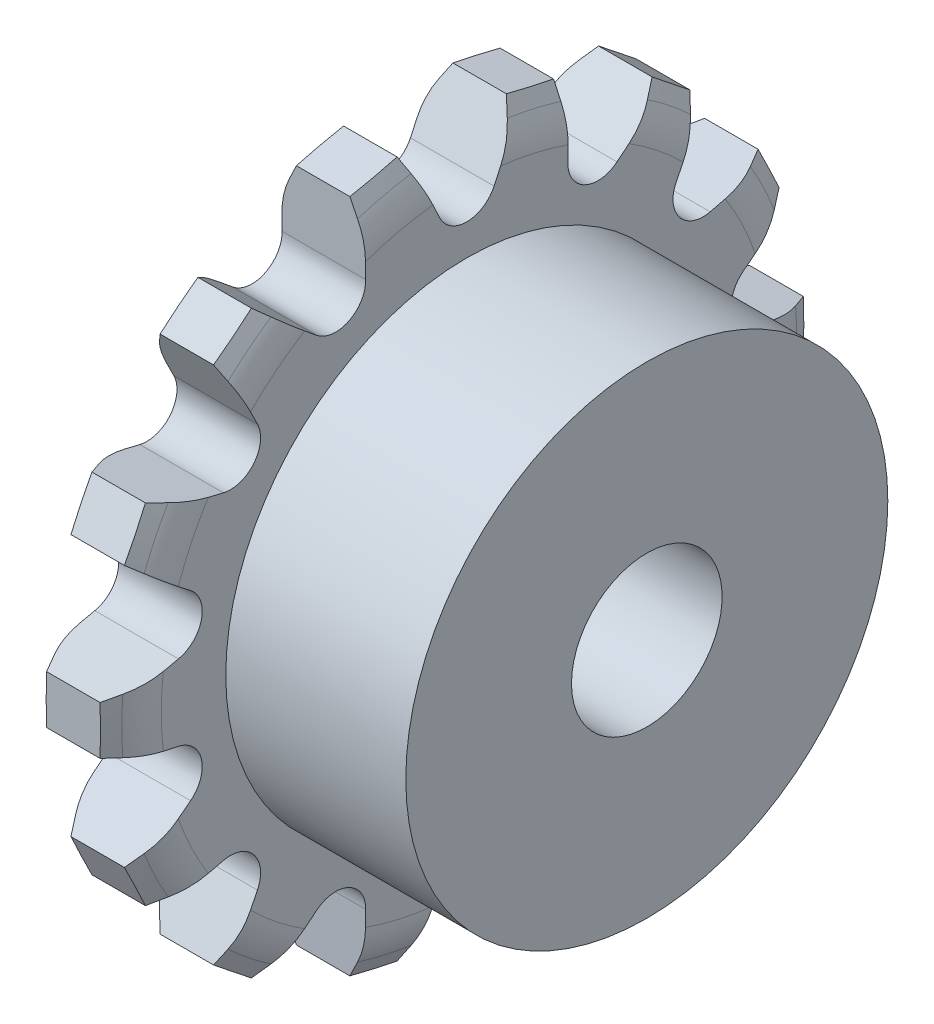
SolidWorks part; units mm, degrees
ref_plane "Plan de face" through (0, 0, 0) normal (0, 0, 1) x (1, 0, 0)
ref_plane "Plan de dessus" through (0, 0, 0) normal (0, 1, 0) x (1, 0, 0)
ref_plane "Plan de droite" through (0, 0, 0) normal (1, 0, 0) x (0, 0, -1)
sketch "Esquisse1" plane through (0, 0, 0) normal (0, 0, 1) x (1, 0, 0)
  line L0 (0, 40.5598) -> (0, 10)
  line L2 (35, 10) -> (35, 32)
  line L3 (35, 32) -> (11.1, 32)
  line L4 (11.1, 32) -> (11.1, 40.5598)
  line L5 (10.0949, 44.8126) -> (9.1, 46.8)
  line L6 (9.1, 46.8) -> (2, 46.8)
  line L7 (2, 46.8) -> (1.0051, 44.8126)
  line L8 (35, 0) -> (0, 0) construction
  line L9 (0, 10) -> (35, 10)
  arc A0 (11.1, 40.5598) -> (10.0949, 44.8126) centre (1.6, 40.5598) ccw
  arc A1 (1.0051, 44.8126) -> (0, 40.5598) centre (9.5, 40.5598) ccw
  dimension "D1" = 10
revolve "Révolution1" add sketch "Esquisse1" angle 360 about L8
ref_plane "Plan1" through (5.55, 0, 0) normal (1, 0, 0) x (0, 0, -1)
sketch "Esquisse2" plane through (5.55, 0, 0) normal (1, 0, 0) x (0, 0, -1)
  line L0 (-46.6894, 3.215) -> (-46.6894, -3.215)
  line L1 (-46.6894, -3.215) -> (-38.2824, -5.0239)
  line L2 (-36.6711, -12.0837) -> (-43.4607, -17.3612)
  line L3 (-43.4607, -17.3612) -> (-40.6708, -23.1544)
  line L4 (-40.6708, -23.1544) -> (-32.3115, -21.1365)
  line L5 (-27.7965, -26.7981) -> (-31.624, -34.4987)
  line L6 (-31.624, -34.4987) -> (-26.5968, -38.5078)
  line L7 (-26.5968, -38.5078) -> (-19.9409, -33.0628)
  line L8 (-13.4166, -36.2047) -> (-13.5238, -44.8034)
  line L9 (-13.5238, -44.8034) -> (-7.255, -46.2342)
  line L10 (-7.255, -46.2342) -> (-3.6207, -38.4405)
  line L11 (3.6207, -38.4405) -> (7.255, -46.2342)
  line L12 (7.255, -46.2342) -> (13.5238, -44.8034)
  line L13 (13.5238, -44.8034) -> (13.4166, -36.2047)
  line L14 (19.9409, -33.0628) -> (26.5968, -38.5078)
  line L15 (26.5968, -38.5078) -> (31.624, -34.4987)
  line L16 (31.624, -34.4987) -> (27.7965, -26.7981)
  line L17 (32.3115, -21.1365) -> (40.6708, -23.1544)
  line L18 (40.6708, -23.1544) -> (43.4607, -17.3612)
  line L19 (43.4607, -17.3612) -> (36.6711, -12.0837)
  line L20 (38.2824, -5.0239) -> (46.6894, -3.215)
  line L21 (46.6894, -3.215) -> (46.6894, 3.215)
  line L22 (46.6894, 3.215) -> (38.2824, 5.0239)
  line L23 (36.6711, 12.0837) -> (43.4607, 17.3612)
  line L24 (43.4607, 17.3612) -> (40.6708, 23.1544)
  line L25 (40.6708, 23.1544) -> (32.3115, 21.1365)
  line L26 (27.7965, 26.7981) -> (31.624, 34.4987)
  line L27 (31.624, 34.4987) -> (26.5968, 38.5078)
  line L28 (26.5968, 38.5078) -> (19.9409, 33.0628)
  line L29 (13.4166, 36.2047) -> (13.5238, 44.8034)
  line L30 (13.5238, 44.8034) -> (7.255, 46.2342)
  line L31 (7.255, 46.2342) -> (3.6207, 38.4405)
  line L32 (-3.6207, 38.4405) -> (-7.255, 46.2342)
  line L33 (-7.255, 46.2342) -> (-13.5238, 44.8034)
  line L34 (-13.5238, 44.8034) -> (-13.4166, 36.2047)
  line L35 (-19.9409, 33.0628) -> (-26.5968, 38.5078)
  line L36 (-26.5968, 38.5078) -> (-31.624, 34.4987)
  line L37 (-31.624, 34.4987) -> (-27.7965, 26.7981)
  line L38 (-32.3115, 21.1365) -> (-40.6708, 23.1544)
  line L39 (-40.6708, 23.1544) -> (-43.4607, 17.3612)
  line L40 (-43.4607, 17.3612) -> (-36.6711, 12.0837)
  line L41 (-38.2824, 5.0239) -> (-46.6894, 3.215)
  circle A0 centre (0, 0) radius 70.2
  arc A1 (-38.2824, -5.0239) -> (-36.6711, -12.0837) centre (-39.1228, -8.9295) cw
  arc A2 (-32.3115, -21.1365) -> (-27.7965, -26.7981) centre (-31.374, -25.02) cw
  arc A3 (-19.9409, -33.0628) -> (-13.4166, -36.2047) centre (-17.4113, -36.1549) cw
  arc A4 (-3.6207, -38.4405) -> (3.6207, -38.4405) centre (0, -40.1289) cw
  arc A5 (13.4166, -36.2047) -> (19.9409, -33.0628) centre (17.4113, -36.1549) cw
  arc A6 (27.7965, -26.7981) -> (32.3115, -21.1365) centre (31.374, -25.02) cw
  arc A7 (36.6711, -12.0837) -> (38.2824, -5.0239) centre (39.1228, -8.9295) cw
  arc A8 (38.2824, 5.0239) -> (36.6711, 12.0837) centre (39.1228, 8.9295) cw
  arc A9 (32.3115, 21.1365) -> (27.7965, 26.7981) centre (31.374, 25.02) cw
  arc A10 (19.9409, 33.0628) -> (13.4166, 36.2047) centre (17.4113, 36.1549) cw
  arc A11 (3.6207, 38.4405) -> (-3.6207, 38.4405) centre (0, 40.1289) cw
  arc A12 (-13.4166, 36.2047) -> (-19.9409, 33.0628) centre (-17.4113, 36.1549) cw
  arc A13 (-27.7965, 26.7981) -> (-32.3115, 21.1365) centre (-31.374, 25.02) cw
  arc A14 (-36.6711, 12.0837) -> (-38.2824, 5.0239) centre (-39.1228, 8.9295) cw
extrude "Enlèv. mat.-Extru.1" cut sketch "Esquisse2" along normal blind 11.1 and the other way blind 11.1
ref_plane "Plan2" through (0, 0, 0) normal (0, 0, 1) x (1, 0, 0)
ref_plane "Plan3" through (0, 0, 0) normal (0, 1, 0) x (-1, 0, 0)
